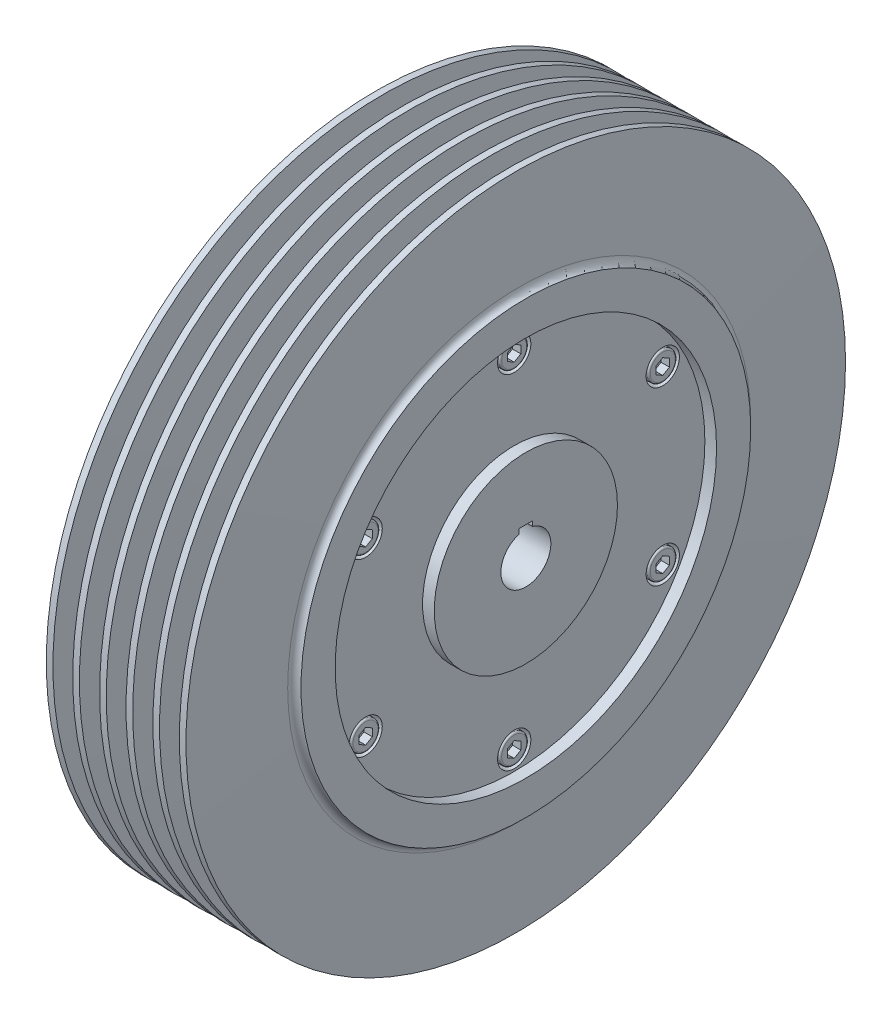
SolidWorks part; units mm, degrees
ref_plane "Plan de face" through (0, 0, 0) normal (0, 0, 1) x (1, 0, 0)
ref_plane "Plan de dessus" through (0, 0, 0) normal (0, 1, 0) x (1, 0, 0)
ref_plane "Plan de droite" through (0, 0, 0) normal (1, 0, 0) x (0, 0, -1)
sketch "Esquisse1" plane through (0, 0, 0) normal (0, 0, 1) x (1, 0, 0)
  line L0 (-170.7302, -13.3292) -> (-171.8852, -11.3287)
  line L1 (-171.8852, -11.3287) -> (-174.1952, -11.3287)
  line L2 (-174.1952, -15.3297) -> (-171.8852, -15.3297)
  line L3 (-171.8852, -15.3297) -> (-170.7302, -13.3292)
  line L4 (-175.3502, -13.3292) -> (-174.1952, -15.3297)
  line L5 (-174.1952, -11.3287) -> (-175.3502, -13.3292)
  line L6 (-187.5244, 38.4165) -> (-188.6794, 36.416)
  line L7 (-188.6794, 36.416) -> (-187.5244, 34.4155)
  line L8 (-187.5244, 34.4155) -> (-185.2144, 34.4155)
  line L9 (-185.2144, 34.4155) -> (-184.0594, 36.416)
  line L10 (-184.0594, 36.416) -> (-185.2144, 38.4165)
  line L11 (-185.2144, 38.4165) -> (-187.5244, 38.4165)
  line L12 (-238.4246, 49.7452) -> (-237.2696, 47.7447)
  line L13 (-237.2696, 47.7447) -> (-234.9596, 47.7447)
  line L14 (-234.9596, 47.7447) -> (-233.8046, 49.7452)
  line L15 (-233.8046, 49.7452) -> (-234.9596, 51.7457)
  line L16 (-234.9596, 51.7457) -> (-237.2696, 51.7457)
  line L17 (-237.2696, 51.7457) -> (-238.4246, 49.7452)
  line L18 (-273.6856, 11.3287) -> (-271.3756, 11.3287)
  line L19 (-271.3756, 11.3287) -> (-270.2206, 13.3292)
  line L20 (-270.2206, 13.3292) -> (-271.3756, 15.3297)
  line L21 (-271.3756, 15.3297) -> (-273.6856, 15.3297)
  line L22 (-273.6856, 15.3297) -> (-274.8406, 13.3292)
  line L23 (-274.8406, 13.3292) -> (-273.6856, 11.3287)
  line L24 (-258.0464, -38.4165) -> (-256.8914, -36.416)
  line L25 (-256.8914, -36.416) -> (-258.0464, -34.4155)
  line L26 (-258.0464, -34.4155) -> (-260.3564, -34.4155)
  line L27 (-260.3564, -34.4155) -> (-261.5114, -36.416)
  line L28 (-261.5114, -36.416) -> (-260.3564, -38.4165)
  line L29 (-260.3564, -38.4165) -> (-258.0464, -38.4165)
  line L30 (-207.1462, -49.7452) -> (-208.3012, -47.7447)
  line L31 (-208.3012, -47.7447) -> (-210.6112, -47.7447)
  line L32 (-210.6112, -47.7447) -> (-211.7662, -49.7452)
  line L33 (-211.7662, -49.7452) -> (-210.6112, -51.7457)
  line L34 (-210.6112, -51.7457) -> (-208.3012, -51.7457)
  line L35 (-208.3012, -51.7457) -> (-207.1462, -49.7452)
  line L36 (-225.2655, -13.5) -> (-223.9854, -13.5)
  line L37 (-221.5854, -13.5) -> (-220.3053, -13.5)
  line L38 (-221.5854, -9.9277) -> (-221.5854, -13.5)
  line L39 (-223.9854, -9.9277) -> (-223.9854, -13.5)
  line L40 (-217.9053, -11.1) -> (-217.9053, -10.6602)
  line L41 (-227.6655, -10.6602) -> (-227.6655, -11.1)
  line L42 (-213.6661, -13.8124) -> (-207.5728, -12.698)
  line L43 (-215.8856, -17.7815) -> (-215.1886, -19.5778)
  line L44 (-229.6852, -17.7815) -> (-230.3822, -19.5778)
  line L45 (-231.9046, -13.8124) -> (-237.9979, -12.698)
  line L46 (-265.2054, 0.4) -> (-265.101, 0.4)
  line L47 (-265.2054, -0.4) -> (-265.101, -0.4)
  line L48 (-265.101, 0.4) -> (-265.101, -0.4)
  line L49 (-270.3654, 0.4) -> (-270.4698, 0.4)
  line L50 (-270.3654, -0.4) -> (-270.4698, -0.4)
  line L51 (-270.4698, 0.4) -> (-270.4698, -0.4)
  line L52 (-270.3654, -0.4) -> (-265.2054, -0.4)
  line L53 (-270.3654, 0.4) -> (-265.2054, 0.4)
  line L54 (-175.2054, 0.4) -> (-175.101, 0.4)
  line L55 (-175.2054, -0.4) -> (-175.101, -0.4)
  line L56 (-175.101, 0.4) -> (-175.101, -0.4)
  line L57 (-180.3654, 0.4) -> (-180.4698, 0.4)
  line L58 (-180.3654, -0.4) -> (-180.4698, -0.4)
  line L59 (-180.4698, 0.4) -> (-180.4698, -0.4)
  line L60 (-180.3654, -0.4) -> (-175.2054, -0.4)
  line L61 (-180.3654, 0.4) -> (-175.2054, 0.4)
  line L62 (-224.7854, 8.7) -> (-220.7854, 8.7)
  line L63 (-220.7854, 7.2284) -> (-220.7854, 8.7)
  line L64 (-224.7854, 7.2284) -> (-224.7854, 8.7)
  line L65 (-43.5038, -57.25) -> (-24.0038, -57.25)
  line L66 (-24.0038, -57.25) -> (-4.5038, -57.25)
  line L67 (-3.5038, -56.25) -> (-3.5038, 56.25)
  line L68 (-3.5038, -27.5) -> (-0.0038, -27.5)
  line L69 (-44.5038, -27.5) -> (-48.0038, -27.5)
  line L70 (-48.0038, 27.5) -> (-48.0038, -27.5)
  line L71 (-0.0038, 27.5) -> (-0.0038, -27.5)
  line L72 (-4.5038, -57.25) -> (-4.5038, -54)
  line L73 (-44.5038, -56.25) -> (-43.5038, -57.25)
  line L74 (-3.5038, -56.25) -> (-4.5038, -57.25)
  line L75 (-43.5038, -57.25) -> (-43.5038, 57.25)
  line L76 (-44.5038, -56.25) -> (-44.5038, 56.25)
  line L77 (-24.0038, 57.25) -> (-4.5038, 57.25)
  line L78 (-43.5038, 57.25) -> (-24.0038, 57.25)
  line L79 (-44.5038, 56.25) -> (-43.5038, 57.25)
  line L80 (-44.5038, 27.5) -> (-48.0038, 27.5)
  line L81 (-3.5038, 56.25) -> (-4.5038, 57.25)
  line L82 (-3.5038, 27.5) -> (-0.0038, 27.5)
  line L83 (-15.5038, 49) -> (-15.5038, 54)
  line L84 (-15.5038, 54) -> (-3.5038, 54)
  line L85 (-15.5038, 49) -> (-3.5038, 49)
  line L86 (-4.5038, 54) -> (-4.5038, 57.25)
  line L87 (-15.5038, 53.6) -> (-3.5038, 53.6)
  line L88 (-15.5038, 49.4) -> (-3.5038, 49.4)
  line L89 (-15.5038, -54) -> (-15.5038, -49)
  line L90 (-15.5038, -49) -> (-3.5038, -49)
  line L91 (-15.5038, -49.4) -> (-3.5038, -49.4)
  line L92 (-15.5038, -54) -> (-3.5038, -54)
  line L93 (-15.5038, -53.6) -> (-3.5038, -53.6)
  line L94 (-4.5038, -49) -> (-4.5038, 49)
  line L95 (-44.9698, 99) -> (-42.9698, 99)
  line L96 (-46, 69.5) -> (-44.9698, 99)
  line L97 (-44.9698, 99) -> (-42.9698, 99)
  line L98 (-42.9698, 99) -> (-41.9403, 69.518)
  line L99 (-37.0302, 99) -> (-38.0597, 69.518)
  line L100 (-34, 69.5) -> (-35.0302, 99)
  line L101 (-35.0302, 99) -> (-37.0302, 99)
  line L102 (-26.9698, 99) -> (-25.9403, 69.518)
  line L103 (-30, 69.5) -> (-28.9698, 99)
  line L104 (-28.9698, 99) -> (-26.9698, 99)
  line L105 (-18, 69.5) -> (-19.0302, 99)
  line L106 (-21.0302, 99) -> (-22.0597, 69.518)
  line L107 (-14, 69.5) -> (-12.9698, 99)
  line L108 (-10.9698, 99) -> (-9.9403, 69.518)
  line L109 (-2, 69.5) -> (-3.0302, 99)
  line L110 (-5.0302, 99) -> (-6.0597, 69.518)
  line L111 (-3.0302, 99) -> (-5.0302, 99)
  line L112 (-3.0302, 99) -> (-5.0302, 99)
  line L113 (-12.9698, 99) -> (-10.9698, 99)
  line L114 (-19.0302, 99) -> (-21.0302, 99)
  line L115 (0, -67.5) -> (0, 67.5)
  line L116 (-48, -67.5) -> (-48, 67.5)
  line L117 (-18, -69.5) -> (-19.0302, -99)
  line L118 (-21.0302, -99) -> (-22.0597, -69.518)
  line L119 (-26.9698, -99) -> (-25.9403, -69.518)
  line L120 (-30, -69.5) -> (-28.9698, -99)
  line L121 (-34, -69.5) -> (-35.0302, -99)
  line L122 (-37.0302, -99) -> (-38.0597, -69.518)
  line L123 (-42.9698, -99) -> (-41.9403, -69.518)
  line L124 (-46, -69.5) -> (-44.9698, -99)
  line L125 (-35.0302, -99) -> (-37.0302, -99)
  line L126 (-44.9698, -99) -> (-42.9698, -99)
  line L127 (-44.9698, -99) -> (-42.9698, -99)
  line L128 (-28.9698, -99) -> (-26.9698, -99)
  line L129 (-19.0302, -99) -> (-21.0302, -99)
  line L130 (-2, -69.5) -> (-3.0302, -99)
  line L131 (-5.0302, -99) -> (-6.0597, -69.518)
  line L132 (-10.9698, -99) -> (-9.9403, -69.518)
  line L133 (-14, -69.5) -> (-12.9698, -99)
  line L134 (-3.0302, -99) -> (-5.0302, -99)
  line L135 (-3.0302, -99) -> (-5.0302, -99)
  line L136 (-12.9698, -99) -> (-10.9698, -99)
  line L137 (0, 57.25) -> (-48, 57.25)
  line L138 (0, -57.25) -> (-48, -57.25)
  line L139 (-0.0038, 0) -> (-80.0025, 0) construction
  circle A0 centre (-222.7854, 0) radius 56.75
  arc A1 (-185.3715, 2.5399) -> (-260.1993, 2.5399) centre (-222.7854, 0) ccw
  circle A2 centre (-222.7854, 0) radius 36.5
  circle A3 centre (-222.7854, 0) radius 35.5
  circle A4 centre (-222.7854, 0) radius 34.5
  circle A5 centre (-222.7854, 0) radius 27.5
  circle A6 centre (-222.7854, 0) radius 21
  circle A7 centre (-222.7854, 0) radius 10
  circle A8 centre (-222.7854, 0) radius 9.5
  arc A9 (-224.7854, 7.2284) -> (-220.7854, 7.2284) centre (-222.7854, 0) ccw
  circle A10 centre (-236.1146, 49.7452) radius 5
  circle A11 centre (-272.5306, 13.3292) radius 5
  circle A12 centre (-259.2014, -36.416) radius 5
  circle A13 centre (-209.4562, -49.7452) radius 5
  circle A14 centre (-173.0402, -13.3292) radius 5
  circle A15 centre (-186.3694, 36.416) radius 5
  circle A16 centre (-173.0402, -13.3292) radius 4.25
  circle A17 centre (-173.0402, -13.3292) radius 2.31
  circle A18 centre (-186.3694, 36.416) radius 4.25
  circle A19 centre (-186.3694, 36.416) radius 2.31
  circle A20 centre (-236.1146, 49.7452) radius 4.25
  circle A21 centre (-236.1146, 49.7452) radius 2.31
  circle A22 centre (-272.5306, 13.3292) radius 4.25
  circle A23 centre (-272.5306, 13.3292) radius 2.31
  circle A24 centre (-259.2014, -36.416) radius 4.25
  circle A25 centre (-259.2014, -36.416) radius 2.31
  circle A26 centre (-209.4562, -49.7452) radius 4.25
  circle A27 centre (-209.4562, -49.7452) radius 2.31
  arc A28 (-216.7868, -8.631) -> (-217.9053, -10.6602) centre (-215.5053, -10.6602) ccw
  arc A29 (-220.3053, -13.5) -> (-217.9053, -11.1) centre (-220.3053, -11.1) ccw
  circle A30 centre (-219.7453, -11.5) radius 1
  arc A31 (-227.6655, -10.6602) -> (-228.7839, -8.631) centre (-230.0655, -10.6602) ccw
  circle A32 centre (-225.8254, -11.5) radius 1
  arc A33 (-227.6655, -11.1) -> (-225.2655, -13.5) centre (-225.2655, -11.1) ccw
  arc A34 (-216.7868, -8.631) -> (-228.7839, -8.631) centre (-222.7854, 0.8667) ccw
  circle A35 centre (-213.1354, -16.7143) radius 1.25
  circle A36 centre (-232.4354, -16.7143) radius 1.25
  arc A37 (-207.5728, -12.698) -> (-237.9979, -12.698) centre (-222.7854, -1.025) ccw
  arc A38 (-213.6661, -13.8124) -> (-215.8856, -17.7815) centre (-213.1354, -16.7143) ccw
  arc A39 (-229.6852, -17.7815) -> (-231.9046, -13.8124) centre (-232.4354, -16.7143) ccw
  circle A40 centre (-267.7854, 0) radius 8
  circle A41 centre (-177.7854, 0) radius 8
  arc A42 (-260.1993, -2.5399) -> (-185.3715, -2.5399) centre (-222.7854, 0) ccw
  circle A43 centre (-222.7854, -51.5) radius 1.5
  circle A44 centre (-178.1851, 25.75) radius 1.5
  circle A45 centre (-267.3857, 25.75) radius 1.5
  circle A46 centre (-177.7854, 0) radius 6.5
  circle A47 centre (-267.7854, 0) radius 6.5
  arc A48 (-270.3654, -0.4) -> (-265.2054, -0.4) centre (-267.7854, 0) ccw
  circle A49 centre (-267.7854, 0) radius 2.8
  arc A50 (-265.2054, 0.4) -> (-270.3654, 0.4) centre (-267.7854, 0) ccw
  arc A51 (-180.3654, -0.4) -> (-175.2054, -0.4) centre (-177.7854, 0) ccw
  circle A52 centre (-177.7854, 0) radius 2.8
  arc A53 (-175.2054, 0.4) -> (-180.3654, 0.4) centre (-177.7854, 0) ccw
  circle A54 centre (-270.3652, -19.7082) radius 1.5
  arc A55 (-224.7854, 7.746) -> (-220.7854, 7.746) centre (-222.7854, 0) ccw
  circle A56 centre (-222.7854, 0) radius 57.25
  arc A57 (-48, 67.5) -> (-46, 69.5) centre (-48, 69.5) ccw
  arc A58 (-41.9403, 69.518) -> (-38.0597, 69.518) centre (-40, 69.418) ccw
  arc A59 (-34, 69.5) -> (-30, 69.5) centre (-32, 69.5) ccw
  arc A60 (-25.9403, 69.518) -> (-22.0597, 69.518) centre (-24, 69.418) ccw
  arc A61 (-2, 69.5) -> (0, 67.5) centre (0, 69.5) ccw
  arc A62 (-9.9403, 69.518) -> (-6.0597, 69.518) centre (-8, 69.418) ccw
  arc A63 (-18, 69.5) -> (-14, 69.5) centre (-16, 69.5) ccw
  arc A64 (-14, -69.5) -> (-18, -69.5) centre (-16, -69.5) ccw
  arc A65 (-46, -69.5) -> (-48, -67.5) centre (-48, -69.5) ccw
  arc A66 (-38.0597, -69.518) -> (-41.9403, -69.518) centre (-40, -69.418) ccw
  arc A67 (-22.0597, -69.518) -> (-25.9403, -69.518) centre (-24, -69.418) ccw
  arc A68 (-30, -69.5) -> (-34, -69.5) centre (-32, -69.5) ccw
  arc A69 (-6.0597, -69.518) -> (-9.9403, -69.518) centre (-8, -69.418) ccw
  arc A70 (0, -67.5) -> (-2, -69.5) centre (0, -69.5) ccw
  circle A71 centre (-222.7854, 0) radius 99
  circle A72 centre (-222.7854, 0) radius 57.25
  circle A73 centre (-222.7854, 0) radius 67.4751
sketch "Esquisse2" plane through (0, 0, 0) normal (0, 0, 1) x (1, 0, 0)
  line L0 (-3.0302, 99) -> (-5.0302, 99) construction
  line L1 (-12.9698, 99) -> (-10.9698, 99) construction
  line L2 (-19.0302, 99) -> (-21.0302, 99) construction
  line L3 (-28.9698, 99) -> (-26.9698, 99) construction
  line L4 (-35.0302, 99) -> (-37.0302, 99) construction
  line L5 (-44.9698, 99) -> (-42.9698, 99) construction
  line L6 (-30, 69.5) -> (-28.9698, 99) construction
  line L7 (-26.9698, 99) -> (-25.9403, 69.518) construction
  line L8 (-21.0302, 99) -> (-22.0597, 69.518) construction
  line L9 (-18, 69.5) -> (-19.0302, 99) construction
  line L10 (-14, 69.5) -> (-12.9698, 99) construction
  line L11 (-10.9698, 99) -> (-9.9403, 69.518) construction
  line L12 (-5.0302, 99) -> (-6.0597, 69.518) construction
  line L13 (-2, 69.5) -> (-3.0302, 99) construction
  line L14 (0, -67.5) -> (0, 67.5) construction
  line L15 (-34, 69.5) -> (-35.0302, 99) construction
  line L16 (-37.0302, 99) -> (-38.0597, 69.518) construction
  line L17 (-42.9698, 99) -> (-41.9403, 69.518) construction
  line L18 (-46, 69.5) -> (-44.9698, 99) construction
  line L19 (-48, -67.5) -> (-48, 67.5) construction
  line L20 (-3.0302, 99) -> (-5.0302, 99)
  line L21 (-12.9698, 99) -> (-10.9698, 99)
  line L22 (-19.0302, 99) -> (-21.0302, 99)
  line L23 (-28.9698, 99) -> (-26.9698, 99)
  line L24 (-35.0302, 99) -> (-37.0302, 99)
  line L25 (-44.9698, 99) -> (-42.9698, 99)
  line L26 (-30, 69.5) -> (-28.9698, 99)
  line L27 (-26.9698, 99) -> (-25.9403, 69.518)
  line L28 (-21.0302, 99) -> (-22.0597, 69.518)
  line L29 (-18, 69.5) -> (-19.0302, 99)
  line L30 (-14, 69.5) -> (-12.9698, 99)
  line L31 (-10.9698, 99) -> (-9.9403, 69.518)
  line L32 (-5.0302, 99) -> (-6.0597, 69.518)
  line L33 (-2, 69.5) -> (-3.0302, 99)
  line L34 (0, 0) -> (0, 67.5)
  line L35 (-34, 69.5) -> (-35.0302, 99)
  line L36 (-37.0302, 99) -> (-38.0597, 69.518)
  line L37 (-42.9698, 99) -> (-41.9403, 69.518)
  line L38 (-46, 69.5) -> (-44.9698, 99)
  line L39 (-48, 0) -> (-48, 67.5)
  line L40 (0, 0) -> (-119.0898, 0) construction
  line L41 (0, 0) -> (-48, 0)
  arc A0 (-2, 69.5) -> (0, 67.5) centre (0, 69.5) ccw construction
  arc A1 (-9.9403, 69.518) -> (-6.0597, 69.518) centre (-8, 69.418) ccw construction
  arc A2 (-18, 69.5) -> (-14, 69.5) centre (-16, 69.5) ccw construction
  arc A3 (-25.9403, 69.518) -> (-22.0597, 69.518) centre (-24, 69.418) ccw construction
  arc A4 (-34, 69.5) -> (-30, 69.5) centre (-32, 69.5) ccw construction
  arc A5 (-41.9403, 69.518) -> (-38.0597, 69.518) centre (-40, 69.418) ccw construction
  arc A6 (-48, 67.5) -> (-46, 69.5) centre (-48, 69.5) ccw construction
  arc A7 (-2, 69.5) -> (0, 67.5) centre (0, 69.5) ccw
  arc A8 (-9.9403, 69.518) -> (-6.0597, 69.518) centre (-8, 69.418) ccw
  arc A9 (-18, 69.5) -> (-14, 69.5) centre (-16, 69.5) ccw
  arc A10 (-25.9403, 69.518) -> (-22.0597, 69.518) centre (-24, 69.418) ccw
  arc A11 (-34, 69.5) -> (-30, 69.5) centre (-32, 69.5) ccw
  arc A12 (-41.9403, 69.518) -> (-38.0597, 69.518) centre (-40, 69.418) ccw
  arc A13 (-48, 67.5) -> (-46, 69.5) centre (-48, 69.5) ccw
revolve "Révolution1" add sketch "Esquisse2" angle 360 about L40
sketch "Esquisse3" plane through (0, 0, 0) normal (0, 0, 1) x (1, 0, 0)
  line L0 (0, 0) -> (-88.9725, 0) construction
  line L3 (-44.5038, 27.5) -> (-48, 27.5)
  line L4 (-44.5038, 27.5) -> (-44.5038, 57.25)
  line L5 (-44.5038, 57.25) -> (-48, 57.25)
  line L6 (-48, 27.5) -> (-48, 57.25)
  line L7 (-3.5038, 27.5) -> (0, 27.5)
  line L8 (-3.5038, 27.5) -> (-3.5038, 57.25)
  line L9 (-3.5038, 57.25) -> (0, 57.25)
  line L10 (0, 27.5) -> (0, 57.25)
revolve "Enlèvement de matière-Révolution4" cut sketch "Esquisse3" angle 360 about L0
sketch "Esquisse4" plane through (-3.5038, 0, 0) normal (1, 0, 0) x (0, 0, -1)
  line L0 (0, 0) -> (0, 51.5) construction
  line L1 (0, 0) -> (44.6003, 25.75) construction
  line L2 (0, 0) -> (44.6003, -25.75) construction
  line L3 (0, 0) -> (-44.6003, 25.75) construction
  line L4 (0, 0) -> (-44.6003, -25.75) construction
  line L5 (0, 0) -> (0, -51.5) construction
  circle A0 centre (0, 0) radius 51.5 construction
  dimension "D1" = 103
  dimension "D2" = 60
  dimension "D3" = 60
  dimension "D4" = 60
  dimension "D5" = 60
  dimension "D6" = 60
hole_wizard "Chambrage pour vis à tête cylindrique à 6 pans creux (ou vis CHC) M51" positions "Esquisse3D1" profile "Esquisse5" counterbore size "M5" standard "Ansi Métrique"
sketch3d "Esquisse3D1"
  point P0 (-3.5038, 25.75, 44.6003)
  point P3 (-3.5038, 51.5, 0)
  point P6 (-3.5038, -25.75, -44.6003)
  point P9 (-3.5038, -51.5, 0)
  point P12 (-3.5038, -25.75, 44.6003)
  point P15 (-3.5038, 25.75, -44.6003)
sketch "Esquisse5" plane through (-3.5038, 25.75, 44.6003) normal (0, 1, 0) x (0, 0, -1)
  line L0 (0, 0) -> (0, 44.4962)
  line L1 (0, 44.4962) -> (2.75, 44.4962)
  line L3 (2.75, 44.4962) -> (2.75, 5)
  line L4 (2.75, 5) -> (5, 5)
  line L5 (5, 5) -> (5, 0)
  line L7 (5, 0) -> (0, 0)
  line L11 (0, -6.35) -> (0, 107.95) construction
  dimension "Diamètre du perçage jusqu'au prochain" = 5.5
  dimension "Profondeur du perçage jusqu'au prochain" = 44.4962
  dimension "Diamètre du chambrage" = 10
  dimension "Profondeur du chambrage" = 5
sketch "Esquisse6" plane through (0, 0, 0) normal (1, 0, 0) x (0, 0, -1)
  line L0 (0, 0) -> (0, 8.7) construction
  line L1 (-2, 8.7) -> (2, 8.7)
  line L2 (-2, 8.7) -> (-2, 7.2284)
  line L4 (2, 8.7) -> (2, 7.2284)
  line L5 (-14.1056, -7.5) -> (16.4829, -7.5) construction
  arc A0 (-2, 7.2284) -> (2, 7.2284) centre (0, 0) ccw
  dimension "D1" = 15
  dimension "D2" = 4
  dimension "D3" = 16.2
extrude "Enlèv. mat.-Extru.1" cut sketch "Esquisse6" against normal through all
inserted part "VIS CHC M5-25"
move or copy body "Corps-Déplacer/Copier2" placed by mates yes
other "<VIS CHC M5-25>-<Chanfrein1>"
pattern_circular "Répétition circulaire1" count 6 over 360 about axis through (0, 0, 0) along (1, 0, 0)
